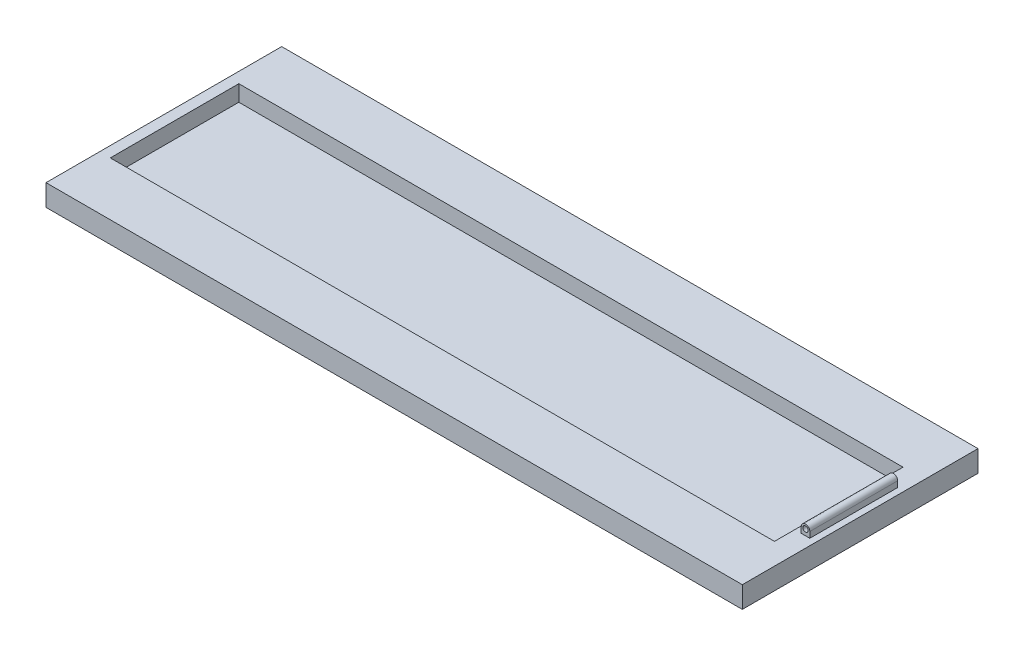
SolidWorks part; units mm, degrees
ref_plane "Face" through (0, 0, 0) normal (0, 0, 1) x (1, 0, 0)
ref_plane "Dessus" through (0, 0, 0) normal (0, 1, 0) x (1, 0, 0)
ref_plane "Droite" through (0, 0, 0) normal (1, 0, 0) x (0, 0, -1)
sketch "Esquisse1" plane through (0, 0, 0) normal (0, 0, 1) x (1, 0, 0)
  line L1 (-6400, -55) -> (100, -55)
  line L2 (-6400, -55) -> (-6400, -255)
  line L3 (-6400, -255) -> (100, -255)
  line L4 (100, -55) -> (100, -255)
  dimension "D1" = 6500
  dimension "D2" = 100
  dimension "D3" = 55
  dimension "D4" = 200
extrude "Extrusion1" add sketch "Esquisse1" along normal mid plane 2200
sketch "Esquisse2" plane through (0, 0, 0) normal (0, 0, 1) x (1, 0, 0)
  line L0 (-40, 0) -> (-40, -55)
  line L1 (100, -55) -> (-6400, -55) construction
  line L2 (-40, -55) -> (40, -55)
  line L3 (40, -55) -> (40, 0)
  circle A0 centre (0, 0) radius 25
  arc A1 (40, 0) -> (-40, 0) centre (0, 0) ccw
  dimension "D1" = 50
  dimension "D2" = 80
extrude "Extrusion2" add sketch "Esquisse2" along normal mid plane 820
sketch "Esquisse3" plane through (0, -55, 0) normal (0, 1, 0) x (1, 0, 0)
  line L0 (100, 1100) -> (-6400, 1100) construction
  line L1 (-6300, 600) -> (-100, 600)
  line L2 (-6300, 600) -> (-6300, -600)
  line L3 (-6300, -600) -> (-100, -600)
  line L4 (-100, 600) -> (-100, -600)
  line L5 (100, -1100) -> (100, 1100) construction
  line L6 (100, -1100) -> (-6400, -1100) construction
  line L7 (-6400, -1100) -> (-6400, 1100) construction
  dimension "D1" = 500
  dimension "D2" = 200
  dimension "D3" = 500
  dimension "D4" = 100
extrude "Enlèv. mat.-Extru.1" cut sketch "Esquisse3" against normal blind 150
